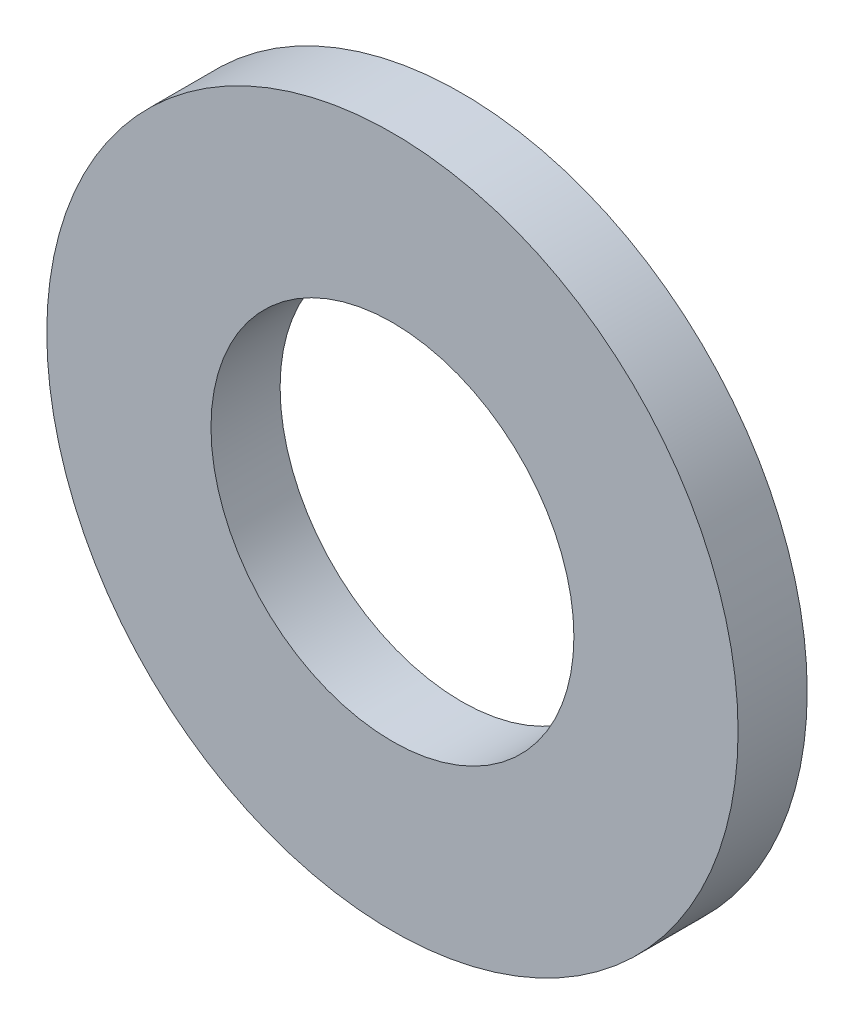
SolidWorks part; units mm, degrees
ref_plane "Ebene vorne" through (0, 0, 0) normal (0, 0, 1) x (1, 0, 0)
ref_plane "Ebene oben" through (0, 0, 0) normal (0, 1, 0) x (1, 0, 0)
ref_plane "Ebene rechts" through (0, 0, 0) normal (1, 0, 0) x (0, 0, -1)
sketch "Skizze1" plane through (0, 0, 0) normal (0, 0, 1) x (1, 0, 0)
  circle A0 centre (0, 0) radius 5.25
  circle A1 centre (0, 0) radius 10
  dimension "D1" = 10.5
  dimension "D2" = 20
extrude "Aufsatz-Linear austragen1" add sketch "Skizze1" along normal blind 2
